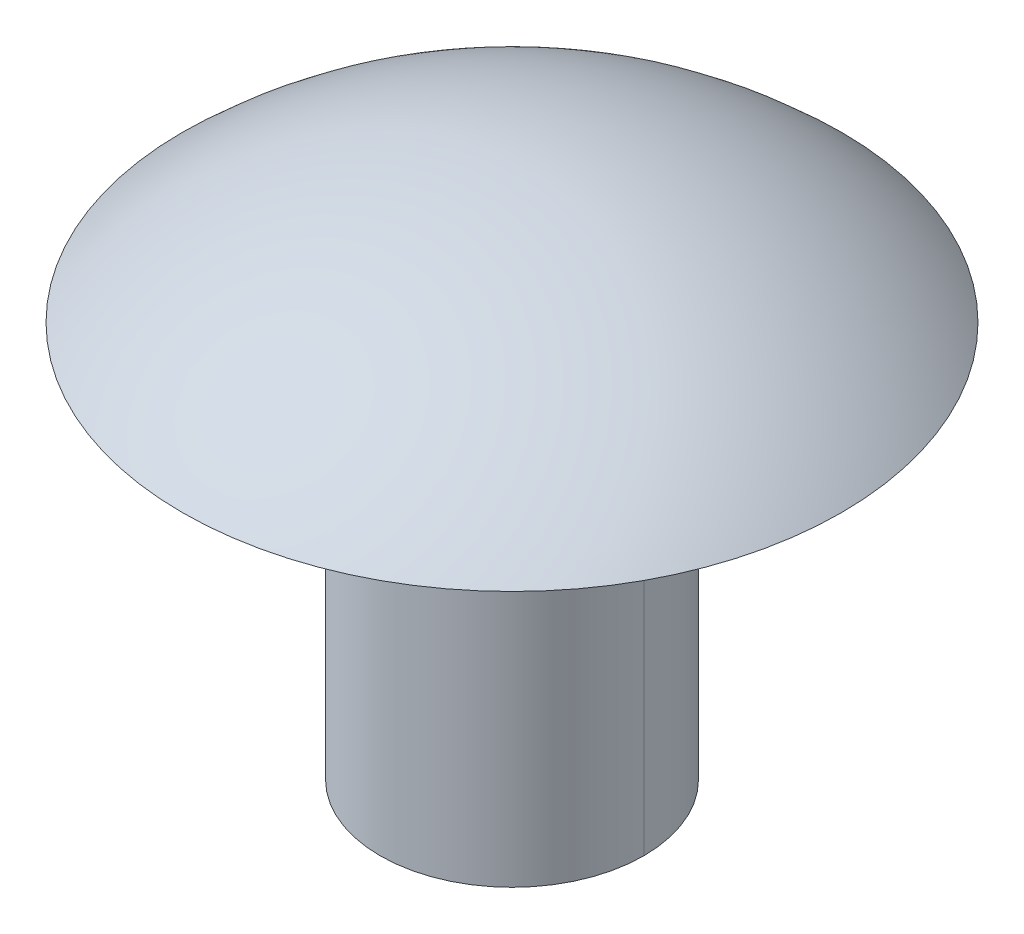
SolidWorks part; units mm, degrees
ref_plane "Front Plane" through (0, 0, 0) normal (0, 0, 1) x (1, 0, 0)
ref_plane "Top Plane" through (0, 0, 0) normal (0, 1, 0) x (1, 0, 0)
ref_plane "Right Plane" through (0, 0, 0) normal (1, 0, 0) x (0, 0, -1)
sketch "Sketch1" plane through (0, 0, 0) normal (0, 1, 0) x (1, 0, 0)
  circle A0 centre (0, 0) radius 4.7625
  dimension "D1" = 9.525
extrude "Boss-Extrude1" add sketch "Sketch1" against normal blind 14.3002
sketch "head diameter" plane through (0, 0, 0) normal (0, 1, 0) x (1, 0, 0)
  circle A0 centre (0, 0) radius 11.8999
  circle A1 centre (0, 0) radius 4.7625 construction
  point P4 (11.8999, 0)
  dimension "D1" = 23.7998
sketch "Sketch3" plane through (0, 0, 0) normal (0, 0, 1) x (1, 0, 0)
  line L0 (0, 4.7498) -> (-9.5218, 4.7498) construction
  line L1 (0, 4.7498) -> (0, 0)
  line L2 (0, 0) -> (11.8999, 0)
  arc A0 (0, 4.7498) -> (11.8999, 0) centre (0, -12.5318) cw
  dimension "D2" = 17.2816
  dimension "D1" = 4.7498
  dimension "D3" = 11.8999
revolve "Revolve1" add sketch "Sketch3" angle 360 about L1
sketch "Sketch5" plane through (0, 0, 0) normal (0, 1, 0) x (1, 0, 0)
  line L0 (-11.8999, 0) -> (11.8999, 0)
  circle A0 centre (0, 0) radius 11.8999 construction
